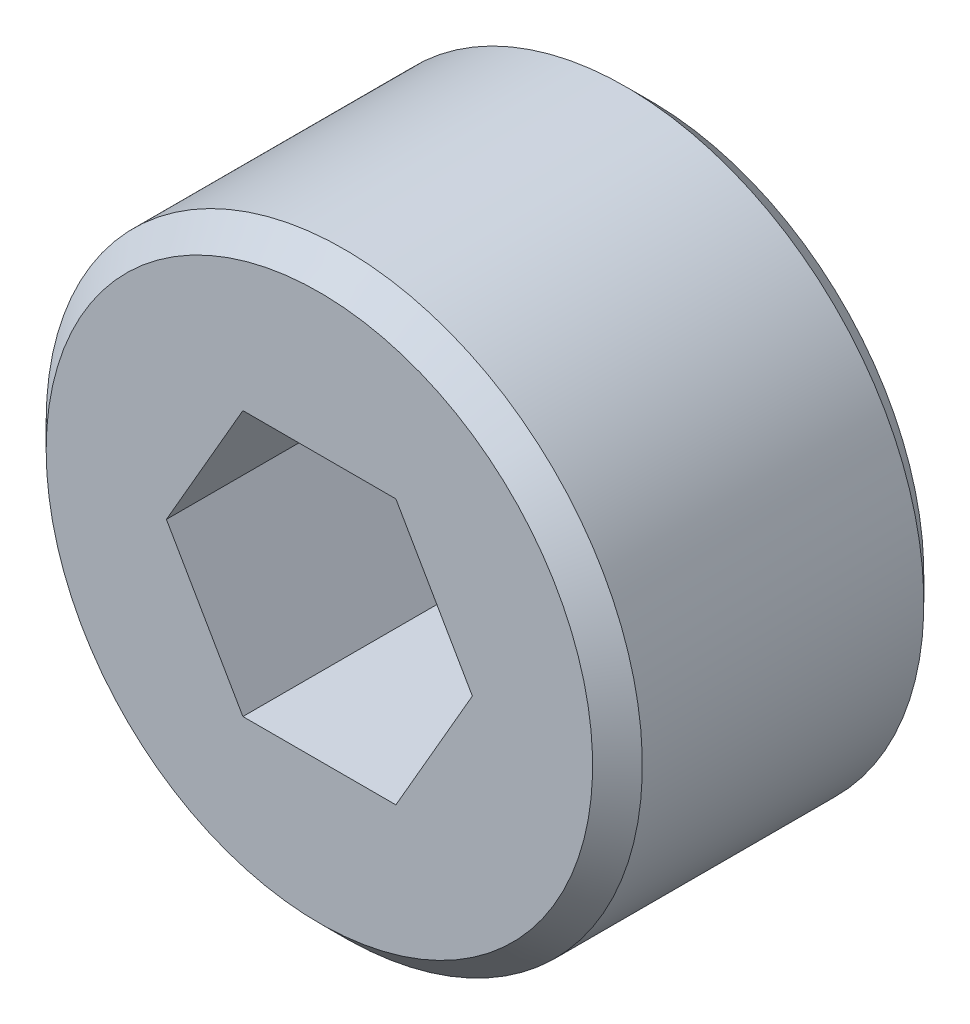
SolidWorks part; units mm, degrees
ref_plane "Front" through (0, 0, 0) normal (0, 0, 1) x (1, 0, 0)
ref_plane "Top" through (0, 0, 0) normal (0, 1, 0) x (1, 0, 0)
ref_plane "Right" through (0, 0, 0) normal (1, 0, 0) x (0, 0, -1)
sketch "Logo3_Revol_Axis" plane through (0, 0, 0) normal (0, 1, 0) x (1, 0, 0)
  line L0 (0, -43.5172) -> (0, 43.5172) construction
sketch "Logo3_bib1" plane through (0, 0, 0) normal (0, -1, 0) x (-1, 0, 0)
  line L0 (0, -7.9375) -> (0, 0)
  line L1 (0, 0) -> (6.5481, 0)
  line L5 (7.1438, -7.3419) -> (6.5481, -7.9375)
  line L6 (6.5481, -7.9375) -> (0, -7.9375)
  line L8 (6.5481, 0) -> (7.1438, -0.5956)
  line L9 (7.1438, -0.5956) -> (7.1438, -7.3419)
  line L10 (0, 10.5852) -> (0, -63.2873) construction
revolve "Revolve1" add sketch "Logo3_bib1" angle 360 about L10
sketch "Logo3_bib2" plane through (0, 0, 0) normal (0, 0, -1) x (1, 0, 0)
  line L1 (3.6662, 0) -> (1.8331, 3.175)
  line L2 (1.8331, 3.175) -> (-1.8331, 3.175)
  line L3 (-1.8331, 3.175) -> (-3.6662, 0)
  line L4 (-3.6662, 0) -> (-1.8331, -3.175)
  line L5 (-1.8331, -3.175) -> (1.8331, -3.175)
  line L6 (1.8331, -3.175) -> (3.6662, 0)
  circle A0 centre (0, 0) radius 3.175 construction
  dimension "Logo3_c1" = 6.35
extrude "Cut-Extrude1" cut sketch "Logo3_bib2" against normal through all
equation "\"D2@Cosmetic Thread1\" = \"Logo3_d1-pas@Logo3_bib1\""
